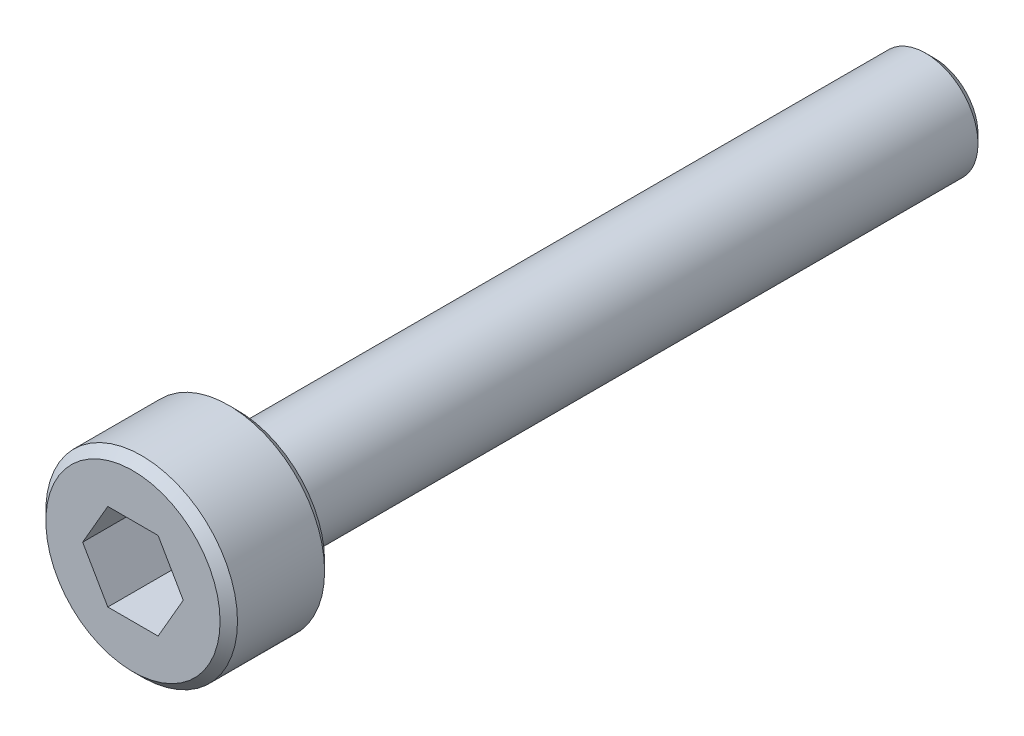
SolidWorks part; units mm, degrees
ref_plane "Front Plane" through (0, 0, 0) normal (1, 0, 0) x (0, 1, 0)
ref_plane "Top Plane" through (0, 0, 0) normal (0, 0, 1) x (0, 1, 0)
ref_plane "Right Plane" through (0, 0, 0) normal (0, 1, 0) x (-1, 0, 0)
sketch "Sketch1" plane through (0, 0, 0) normal (0, 0, 1) x (0, 1, 0)
  circle A0 centre (0, 0) radius 1.5
  dimension "D1" = 3
extrude "Boss-Extrude1" add sketch "Sketch1" along normal blind 20
sketch "Sketch2" plane through (0, 0, 20) normal (0, 0, 1) x (1, 0, 0)
  circle A0 centre (0, 0) radius 2.75
  dimension "D1" = 5.5
extrude "Boss-Extrude2" add sketch "Sketch2" along normal blind 3
chamfer "Chamfer1" distance 0.25 angle 45 3 edges at (2.75, 0, 20) (1.5, 0, 0) (2.75, 0, 23)
sketch "Sketch3" plane through (0, 0, 23) normal (0, 0, 1) x (1, 0, 0)
  line L1 (1.4434, 0) -> (0.7217, 1.25)
  line L2 (0.7217, 1.25) -> (-0.7217, 1.25)
  line L3 (-0.7217, 1.25) -> (-1.4434, 0)
  line L4 (-1.4434, 0) -> (-0.7217, -1.25)
  line L5 (-0.7217, -1.25) -> (0.7217, -1.25)
  line L6 (0.7217, -1.25) -> (1.4434, 0)
  circle A0 centre (0, 0) radius 1.25 construction
  dimension "D1" = 2.5
extrude "Cut-Extrude1" cut sketch "Sketch3" against normal blind 2
